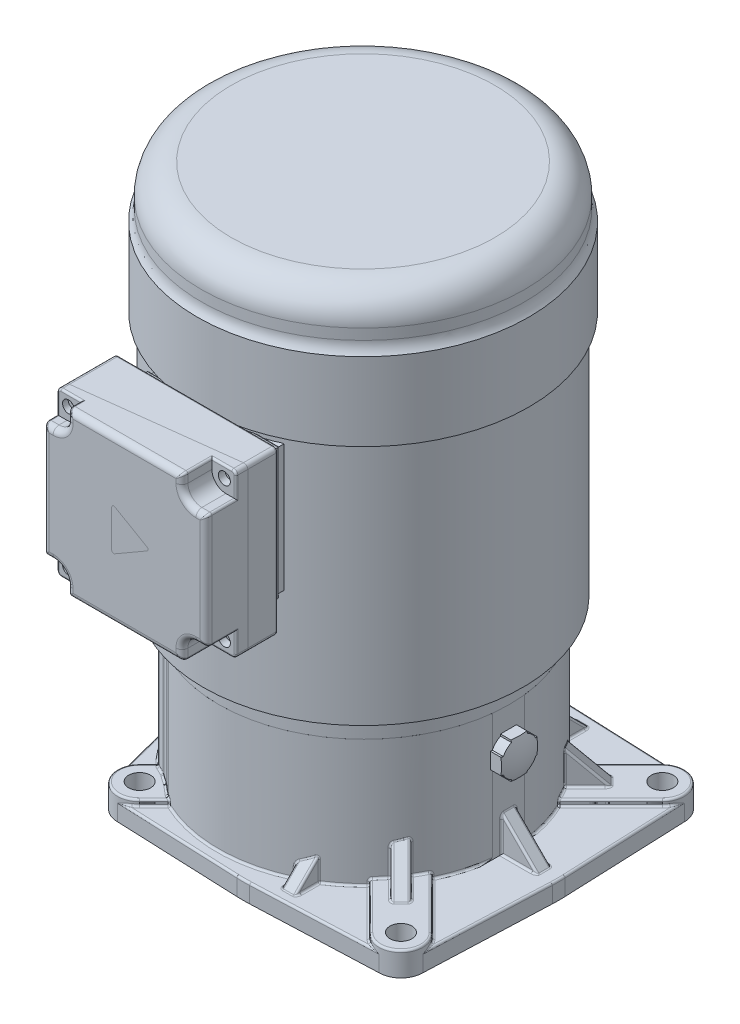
SolidWorks part; units mm, degrees
ref_plane "前视基准面" through (0, 0, 0) normal (0, 0, 1) x (1, 0, 0)
ref_plane "上视基准面" through (0, 0, 0) normal (0, 1, 0) x (1, 0, 0)
ref_plane "右视基准面" through (0, 0, 0) normal (1, 0, 0) x (0, 0, -1)
imported_body "接线盒座-1-surface1"
imported_body "接线盒座-1-surface2"
imported_body "接线盒座-1-surface3"
imported_body "接线盒座-1-surface4"
imported_body "接线盒座-1-surface5"
imported_body "接线盒座-1-surface6"
imported_body "接线盒盖-1-surface1"
imported_body "接线盒盖-1-surface2"
imported_body "接线盒盖-1-surface3"
imported_body "立式箱体装配.SLDPRT-1/15.11.08 22箱盖B-1-surface1"
imported_body "立式箱体装配.SLDPRT-1/15.05.20 22立式B-1-surface1"
imported_body "立式箱体装配.SLDPRT-1/3轴22-1-surface1"
imported_body "立式箱体装配.SLDPRT-1/3轴22-1-surface2"
imported_body "立式箱体装配.SLDPRT-1/GB／T13871．1-2007唇形密封圈B型B1525X40X7-1-surface1"
imported_body "立式箱体装配.SLDPRT-1/透气塞-1-surface1"
imported_body "立式箱体装配.SLDPRT-1/7X32-1-surface1"
sketch "草图1" plane through (0, -137.0976, 0) normal (0, 1, 0) x (1, 0, 0)
  circle A0 centre (222.7594, 100.0202) radius 80
  circle A1 centre (241.749, 100.0202) radius 18.9896 construction
extrude "凸台-拉伸1" add sketch "草图1" along normal blind 123
sketch "草图2" plane through (0, -14.0976, 0) normal (0, 1, 0) x (1, 0, 0)
  circle A0 centre (222.7594, 100.0202) radius 83
extrude "凸台-拉伸2" add sketch "草图2" along normal blind 39
sketch "草图3" plane through (0, 24.9024, 0) normal (0, 1, 0) x (1, 0, 0)
  circle A0 centre (222.7594, 100.0202) radius 81
extrude "凸台-拉伸3" add sketch "草图3" along normal blind 26
fillet "圆角1" radius 15 1 edges at (222.7594, 50.9024, -19.0202)
fillet "圆角2" radius 9 1 edges at (222.7594, 24.9024, -19.0202)
